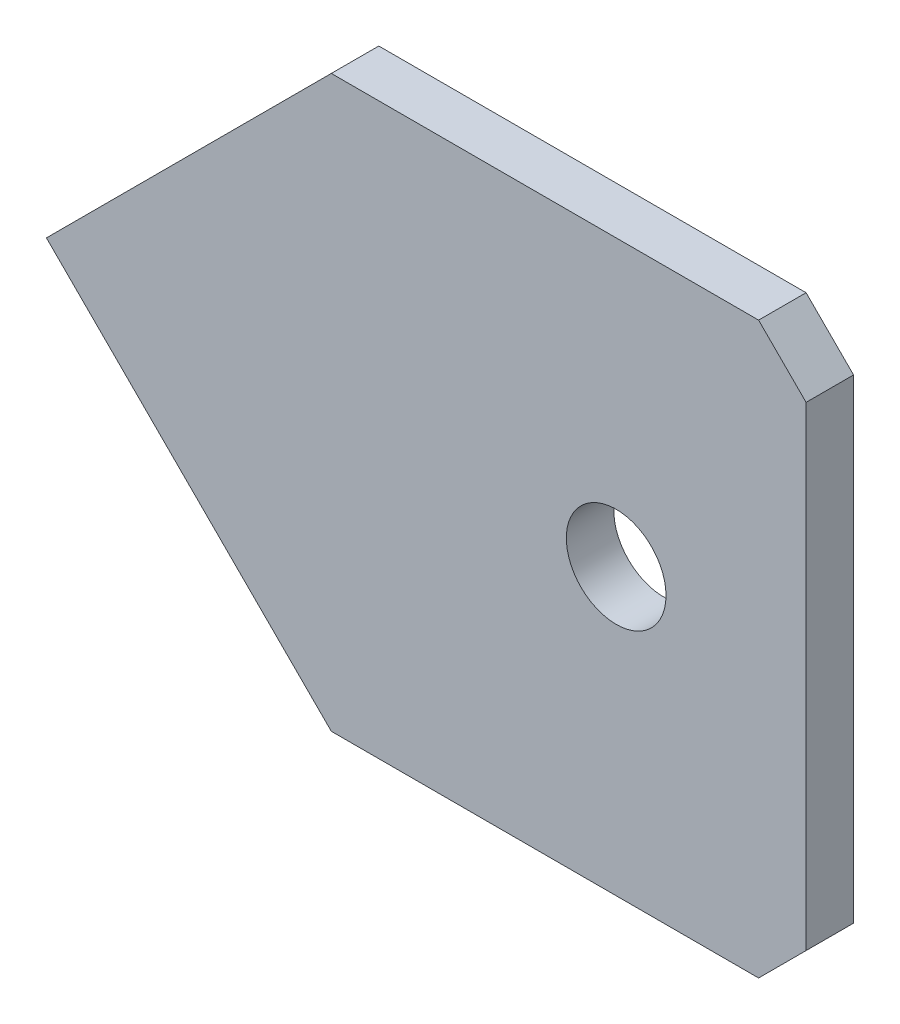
SolidWorks part; units mm, degrees
ref_plane "Přední" through (0, 0, 0) normal (0, 0, 1) x (1, 0, 0)
ref_plane "Horní" through (0, 0, 0) normal (0, 1, 0) x (1, 0, 0)
ref_plane "Pravá" through (0, 0, 0) normal (1, 0, 0) x (0, 0, -1)
sketch "Skica1" plane through (0, 0, 0) normal (0, 0, 1) x (1, 0, 0)
  line L0 (40, 30) -> (-40, -30) construction
  line L1 (-40, 30) -> (40, 30)
  line L2 (-40, 30) -> (-40, -30)
  line L3 (-40, -30) -> (40, -30)
  line L4 (40, 30) -> (40, -30)
  dimension "D1" = 60
  dimension "D2" = 80
extrude "Extrude1" add sketch "Skica1" along normal blind 5
hole_wizard "M10.5 (10.500000)" positions "Skica3" profile "Skica2" hole size "M10.5" standard "ISO"
sketch "Skica3" plane through (0, 0, 5) normal (0, 0, 1) x (1, 0, 0)
  line L0 (40, -30) -> (40, 30) construction
  point P0 (20, 0)
  dimension "D1" = 20
sketch "Skica2" plane through (20, 0, 5) normal (1, 0, 0) x (0, -1, 0)
  line L0 (0, 0) -> (0, 18.1545)
  line L1 (0, 18.1545) -> (5.25, 15)
  line L2 (5.25, 15) -> (5.25, 0)
  line L5 (5.25, 0) -> (0, 0)
  line L10 (0, 18.1545) -> (-5.25, 15) construction
  line L11 (0, -6.35) -> (0, 107.95) construction
  dimension "Prùmìr díry" = 10.5
  dimension "Hloubka díry" = 15
  dimension "Úhel vrtání" = 118
sketch "Skica4" plane through (0, 0, 5) normal (0, 0, 1) x (1, 0, 0)
  line L0 (-10, 30) -> (-40, 0)
  line L1 (40, 30) -> (-40, 30) construction
  line L2 (-40, 30) -> (-40, -30) construction
  line L3 (-40, 0) -> (-10, -30)
  line L4 (-40, -30) -> (40, -30) construction
  line L5 (-10, 30) -> (-10, -30) construction
extrude "Odebrat vysunutím1" cut sketch "Skica4" against normal through all and the other way through all flip side to cut
chamfer "Zkosit1" distance 5 angle 45 2 edges at (40, 30, 2.5) (40, -30, 2.5)
